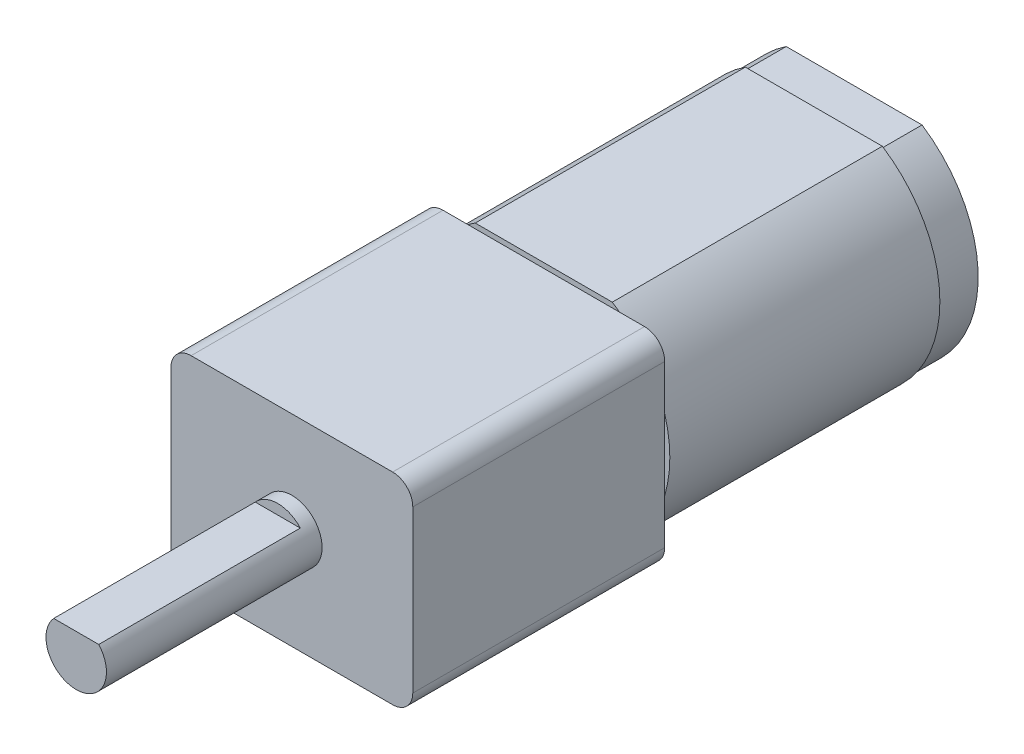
SolidWorks part; units mm, degrees
ref_plane "Plan de face" through (0, 0, 0) normal (0, 0, 1) x (1, 0, 0)
ref_plane "Plan de dessus" through (0, 0, 0) normal (0, 1, 0) x (1, 0, 0)
ref_plane "Plan de droite" through (0, 0, 0) normal (1, 0, 0) x (0, 0, -1)
sketch "Esquisse1" plane through (0, 0, 0) normal (0, 0, 1) x (1, 0, 0)
  line L0 (-6, -5) -> (6, 5) construction
  line L1 (-5, 5) -> (5, 5)
  line L2 (-6, 4) -> (-6, -4)
  line L3 (-5, -5) -> (5, -5)
  line L4 (6, 4) -> (6, -4)
  arc A0 (-5, 5) -> (-6, 4) centre (-5, 4) ccw
  arc A1 (6, 4) -> (5, 5) centre (5, 4) ccw
  arc A2 (6, -4) -> (5, -5) centre (5, -4) cw
  arc A3 (-6, -4) -> (-5, -5) centre (-5, -4) ccw
  point P4 (0, 0)
  point P9 (-6, 5)
  dimension "D3" = 1
  dimension "D1" = 12
  dimension "D2" = 10
extrude "Extrusion1" add sketch "Esquisse1" against normal blind 12.5
sketch "Esquisse2" plane through (0, 0, 0) normal (0, 0, 1) x (1, 0, 0)
  circle A0 centre (0, 0) radius 1.5
  dimension "D1" = 3
extrude "Extrusion2" add sketch "Esquisse2" along normal blind 0.7
sketch "Esquisse3" plane through (0, 0, 0.7) normal (0, 0, 1) x (1, 0, 0)
  line L0 (-1.118, 1) -> (1.118, 1)
  circle A0 centre (0, 0) radius 1.5 construction
  arc A1 (1.118, 1) -> (-1.118, 1) centre (0, 0) cw
  dimension "D1" = 1
extrude "Extrusion3" add sketch "Esquisse3" along normal blind 10
sketch "Esquisse4" plane through (0, 0, -12.5) normal (0, 0, -1) x (-1, 0, 0)
  line L0 (-3.3991, 5.25) -> (3.3991, 5.25)
  line L2 (-5, 5) -> (5, 5) construction
  line L4 (0, 0) -> (2.3194, 0) construction
  line L5 (-3.3991, -5.25) -> (3.3991, -5.25)
  arc A1 (-3.3991, 5.25) -> (-3.3991, -5.25) centre (0, 0) ccw
  arc A2 (3.3991, -5.25) -> (3.3991, 5.25) centre (0, 0) ccw
  dimension "D1" = 0.25
extrude "Extrusion4" add sketch "Esquisse4" along normal blind 13.4
sketch "Esquisse5" plane through (0, 0, -25.9) normal (0, 0, -1) x (-1, 0, 0)
  line L6 (-3.3695, -5.15) -> (3.3695, -5.15)
  line L7 (3.3695, 5.15) -> (-3.3695, 5.15)
  line L8 (-3.3695, -5.15) -> (3.3695, -5.15)
  line L9 (3.3695, 5.15) -> (-3.3695, 5.15)
  arc A6 (-3.3695, 5.15) -> (-3.3695, -5.15) centre (0, 0) ccw
  arc A7 (3.3695, -5.15) -> (3.3695, 5.15) centre (0, 0) ccw
  arc A8 (-3.3695, 5.15) -> (-3.3695, -5.15) centre (0, 0) ccw
  arc A9 (3.3695, -5.15) -> (3.3695, 5.15) centre (0, 0) ccw
  dimension "D1" = 0.1
extrude "Extrusion5" add sketch "Esquisse5" along normal blind 2
